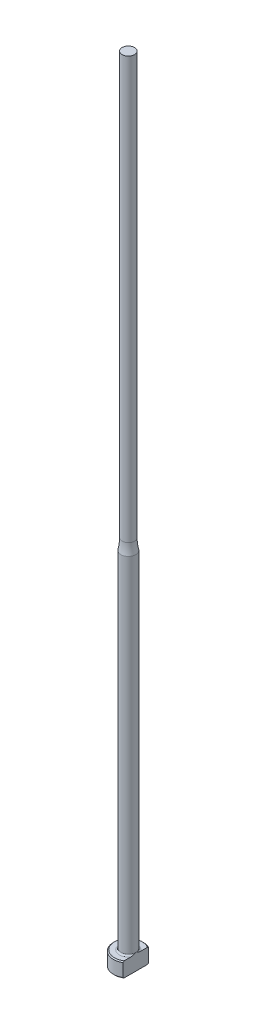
SolidWorks part; units mm, degrees
ref_plane "Front Plane" through (0, 0, 0) normal (0, 0, 1) x (1, 0, 0)
ref_plane "Top Plane" through (0, 0, 0) normal (0, 1, 0) x (1, 0, 0)
ref_plane "Right Plane" through (0, 0, 0) normal (1, 0, 0) x (0, 0, -1)
sketch "Sketch1" plane through (0, 0, 0) normal (0, 0, 1) x (1, 0, 0)
  line L0 (0, 259.9588) -> (0, -15.1925) construction
  line L1 (0, 0) -> (-3, 0)
  line L2 (-3, 0) -> (-3, 3)
  line L3 (-3, 3) -> (-1.5, 3)
  line L4 (-1.25, 75) -> (-1.25, 160)
  line L5 (-1.25, 160) -> (0, 160)
  line L6 (0, 160) -> (0, 0)
  line L7 (-1.5, 3) -> (-1.5, 72.778)
  arc A0 (-1.5, 72.778) -> (-1.25, 75) centre (-11.25, 75) ccw
  point P13 (-1.5, 0)
  dimension "D1" = 10
  dimension "L" = 160
  dimension "H" = 6
  dimension "T" = 3
  dimension "D" = 2.5
  dimension "B" = 3
  dimension "S" = 75
revolve "Revolve1" add sketch "Sketch1" angle 360 about L0
chamfer "Chamfer1" distance 0.2 angle 45 2 edges at (0, 3, 3) (0, 0, 3)
fillet "Fillet1" radius 0.3 1 edges at (0, 3, 1.5)
sketch "Sketch2" plane through (0, 0, 0) normal (0, 1, 0) x (1, 0, 0)
  line L0 (1.5, 2.5981) -> (1.5, -2.5981)
  circle A0 centre (0, 0) radius 3 construction
  arc A1 (1.5, -2.5981) -> (1.5, 2.5981) centre (0, 0) ccw
  circle A2 centre (0, 0) radius 1.5 construction
extrude "KEY" cut sketch "Sketch2" along normal through all
